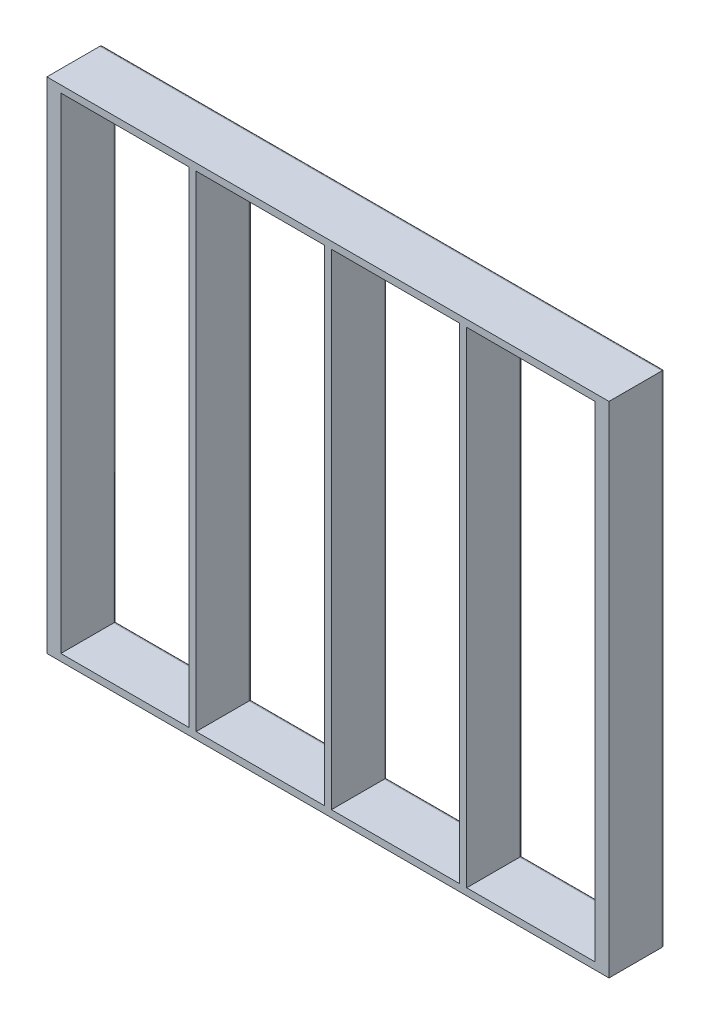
SolidWorks part; units mm, degrees
ref_plane "Front Plane" through (0, 0, 0) normal (0, 0, 1) x (1, 0, 0)
ref_plane "Top Plane" through (0, 0, 0) normal (0, 1, 0) x (1, 0, 0)
ref_plane "Right Plane" through (0, 0, 0) normal (1, 0, 0) x (0, 0, -1)
sketch "Sketch1" plane through (0, 0, 0) normal (0, 0, 1) x (1, 0, 0)
  line L0 (-28, 89.5) -> (-28, -89.5)
  line L5 (-23, -87) -> (23, -87)
  line L6 (-23, -87) -> (-23, 87)
  line L11 (-23, 87) -> (23, 87)
  line L12 (23, -87) -> (23, 87)
  line L13 (-23, -87) -> (23, 87) construction
  line L14 (-23, 87) -> (23, -87) construction
  line L15 (-28, 89.5) -> (24.25, 89.5)
  line L21 (24.25, 89.5) -> (24.25, -89.5)
  line L22 (-28, -89.5) -> (24.25, -89.5)
  line L23 (24.25, 89.5) -> (24.25, -89.5)
  line L24 (25.5, -87) -> (71.5, -87)
  line L25 (25.5, -87) -> (25.5, 87)
  line L26 (25.5, 87) -> (71.5, 87)
  line L27 (71.5, -87) -> (71.5, 87)
  line L28 (25.5, -87) -> (71.5, 87) construction
  line L33 (25.5, 87) -> (71.5, -87) construction
  line L41 (24.25, -89.5) -> (121.25, -89.5)
  line L42 (72.75, -89.5) -> (72.75, 89.5)
  line L43 (121.25, 89.5) -> (24.25, 89.5)
  line L44 (120, 87) -> (74, -87) construction
  line L45 (120, -87) -> (74, 87) construction
  line L46 (168.5, 87) -> (122.5, -87) construction
  line L47 (168.5, -87) -> (122.5, 87) construction
  line L48 (74, -87) -> (74, 87)
  line L49 (120, 87) -> (74, 87)
  line L50 (120, -87) -> (120, 87)
  line L51 (120, -87) -> (74, -87)
  line L52 (121.25, 89.5) -> (121.25, -89.5)
  line L53 (173.5, -89.5) -> (121.25, -89.5)
  line L54 (121.25, 89.5) -> (121.25, -89.5)
  line L55 (173.5, 89.5) -> (121.25, 89.5)
  line L56 (122.5, -87) -> (122.5, 87)
  line L57 (168.5, 87) -> (122.5, 87)
  line L58 (168.5, -87) -> (168.5, 87)
  line L59 (168.5, -87) -> (122.5, -87)
  line L60 (173.5, 89.5) -> (173.5, -89.5)
  line L61 (121.25, 89.5) -> (173.5, 89.5)
  point P0 (0, 0)
  point P6 (48.5, 0)
  point P30 (97, 0)
  point P31 (145.5, 0)
  dimension "D1" = 46
  dimension "D2" = 174
  dimension "D3" = 2.5
  dimension "D4" = 5
  dimension "D5" = 2.5
  dimension "D6" = 1.25
  dimension "D7" = 46
  dimension "D8" = 174
  dimension "D9" = 1.25
  dimension "D11" = 1.25
  dimension "D12" = 2.5
  dimension "D13" = 0
  dimension "D14" = 0
extrude "Boss-Extrude1" add sketch "Sketch1" along normal blind 20
fillet "Fillet4" radius 1 20 edges at (145.5, -87, 0) (122.5, 0, 0) (145.5, 87, 0) (168.5, 0, 0) (97, -87, 0) (74, 0, 0) (97, 87, 0) (120, 0, 0) (48.5, -87, 0) (25.5, 0, 0) (48.5, 87, 0) (71.5, 0, 0) (72.75, -89.5, 0) (173.5, 0, 0) (72.75, 89.5, 0) (-28, 0, 0) (0, -87, 0) (-23, 0, 0) (0, 87, 0) (23, 0, 0)
